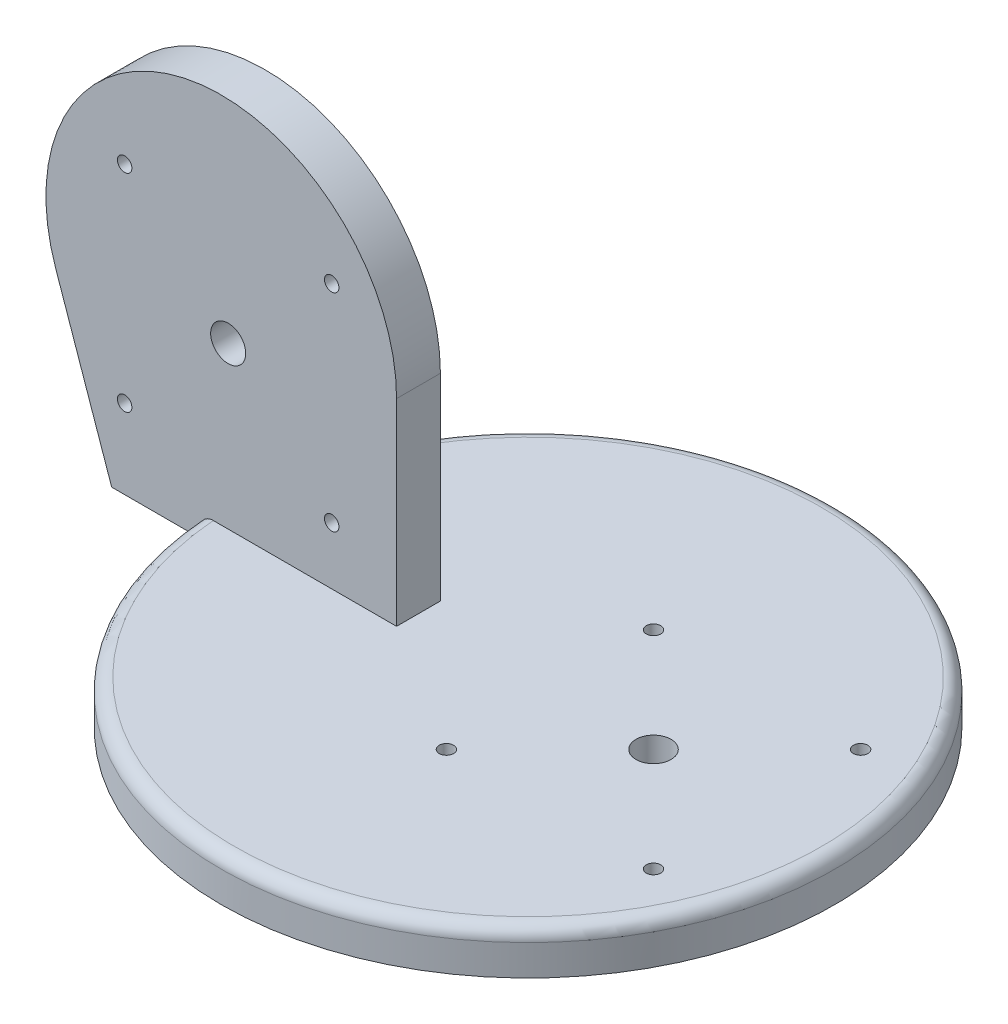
SolidWorks part; units mm, degrees
ref_plane "Front Plane" through (0, 0, 0) normal (0, 0, 1) x (1, 0, 0)
ref_plane "Top Plane" through (0, 0, 0) normal (0, 1, 0) x (1, 0, 0)
ref_plane "Right Plane" through (0, 0, 0) normal (1, 0, 0) x (0, 0, -1)
sketch "Sketch1" plane through (0, 0, 0) normal (0, 1, 0) x (1, 0, 0)
  circle A0 centre (0, 0) radius 70
  dimension "D1" = 140
extrude "Boss-Extrude1" add sketch "Sketch1" along normal blind 10
sketch "Sketch2" plane through (0, 0, 0) normal (0, -1, 0) x (1, 0, 0)
  circle A2 centre (0, 0) radius 65
  circle A3 centre (0, 0) radius 65
  dimension "D1" = 5
extrude "Boss-Extrude4" add sketch "Sketch2" along normal blind 3
sketch "Sketch3" plane through (0, 0, 0) normal (0, 0, 1) x (1, 0, 0)
  line L0 (-25, 55) -> (-25, 5)
  line L1 (-25, 5) -> (-90, 5)
  line L2 (-90, 5) -> (-102.7928, 41.8964)
  arc A0 (-102.7928, 41.8964) -> (-25, 55) centre (-65, 55) cw
  dimension "D3" = 40
  dimension "D1" = 25
  dimension "D2" = 5
  dimension "D4" = 65
  dimension "D5" = 50
extrude "Boss-Extrude5" add sketch "Sketch3" along normal mid plane 10
hole_wizard "M4x0.7 Tapped Hole1" positions "Sketch5" profile "Sketch6" tap size "M4x0.7" standard "ANSI Metric"
sketch "Sketch5" plane through (0, 10, 0) normal (0, 1, 0) x (1, 0, 0)
  point P0 (5, 23.622)
  point P2 (52.244, 23.622)
  point P4 (52.244, -23.622)
  point P6 (5, -23.622)
  dimension "D1" = 47.244
  dimension "D2" = 47.244
sketch "Sketch6" plane through (5, 10, -23.622) normal (1, 0, 0) x (0, 0, 1)
  line L0 (0, 0) -> (0, 6.9914)
  line L1 (0, 6.9914) -> (1.65, 6)
  line L2 (1.65, 6) -> (1.65, 0)
  line L5 (1.65, 0) -> (0, 0)
  line L10 (0, 6.9914) -> (-1.65, 6) construction
  line L11 (0, -6.35) -> (0, 107.95) construction
  dimension "Tap Drill Dia." = 3.3
  dimension "Tap Drill Depth" = 6
  dimension "Drill Angle" = 118
hole_wizard "Ø8.0mm Dowel Hole2" positions "Sketch9" profile "Sketch10" hole size "Ø8.0" standard "ANSI Metric"
sketch "Sketch9" plane through (0, 0, -5) normal (0, 0, -1) x (1, 0, 0)
  point P0 (-63.4203, -46.697)
sketch "Sketch10" plane through (-63.4203, 46.697, -5) normal (1, 0, 0) x (0, 1, 0)
  line L0 (0, 0) -> (0, 75)
  line L1 (0, 75) -> (4, 75)
  line L2 (4, 75) -> (4, 0)
  line L5 (4, 0) -> (0, 0)
  line L11 (0, -6.35) -> (0, 107.95) construction
  dimension "Thru Hole Dia." = 8
  dimension "Thru Hole Depth" = 75
hole_wizard "M4x0.7 Tapped Hole3" positions "Sketch15" profile "Sketch16" tap size "M4x0.7" standard "ANSI Metric"
sketch "Sketch15" plane through (0, 0, 5) normal (0, 0, 1) x (1, 0, 0)
  circle A0 centre (-63.4203, 46.697) radius 4 construction
  point P0 (-87.0403, 70.317)
  point P2 (-39.8003, 70.317)
  point P4 (-39.8003, 23.077)
  point P6 (-87.0403, 23.077)
  dimension "D1" = 47.24
  dimension "D2" = 47.24
  dimension "D3" = 23.62
  dimension "D4" = 23.62
sketch "Sketch16" plane through (-87.0403, 70.317, 5) normal (1, 0, 0) x (0, -1, 0)
  line L0 (0, 0) -> (0, 6.9914)
  line L1 (0, 6.9914) -> (1.65, 6)
  line L2 (1.65, 6) -> (1.65, 0)
  line L5 (1.65, 0) -> (0, 0)
  line L10 (0, 6.9914) -> (-1.65, 6) construction
  line L11 (0, -6.35) -> (0, 107.95) construction
  dimension "Tap Drill Dia." = 3.3
  dimension "Tap Drill Depth" = 6
  dimension "Drill Angle" = 118
hole_wizard "Ø8.0mm Dowel Hole3" positions "Sketch17" profile "Sketch18" hole size "Ø8.0" standard "ANSI Metric"
sketch "Sketch17" plane through (0, 10, 0) normal (0, 1, 0) x (1, 0, 0)
  circle A1 centre (52.244, 23.622) radius 1.65 construction
  circle A2 centre (52.244, -23.622) radius 1.65 construction
  point P0 (28.624, -0.002)
  dimension "D1" = 23.62
  dimension "D2" = 23.62
sketch "Sketch18" plane through (28.624, 10, 0.002) normal (1, 0, 0) x (0, 0, 1)
  line L0 (0, 0) -> (0, 13)
  line L1 (0, 13) -> (4, 13)
  line L2 (4, 13) -> (4, 0)
  line L5 (4, 0) -> (0, 0)
  line L11 (0, -6.35) -> (0, 107.95) construction
  dimension "Thru Hole Dia." = 8
  dimension "Thru Hole Depth" = 13
fillet "Fillet1" radius 3 1 edges at (70, 10, 0)
